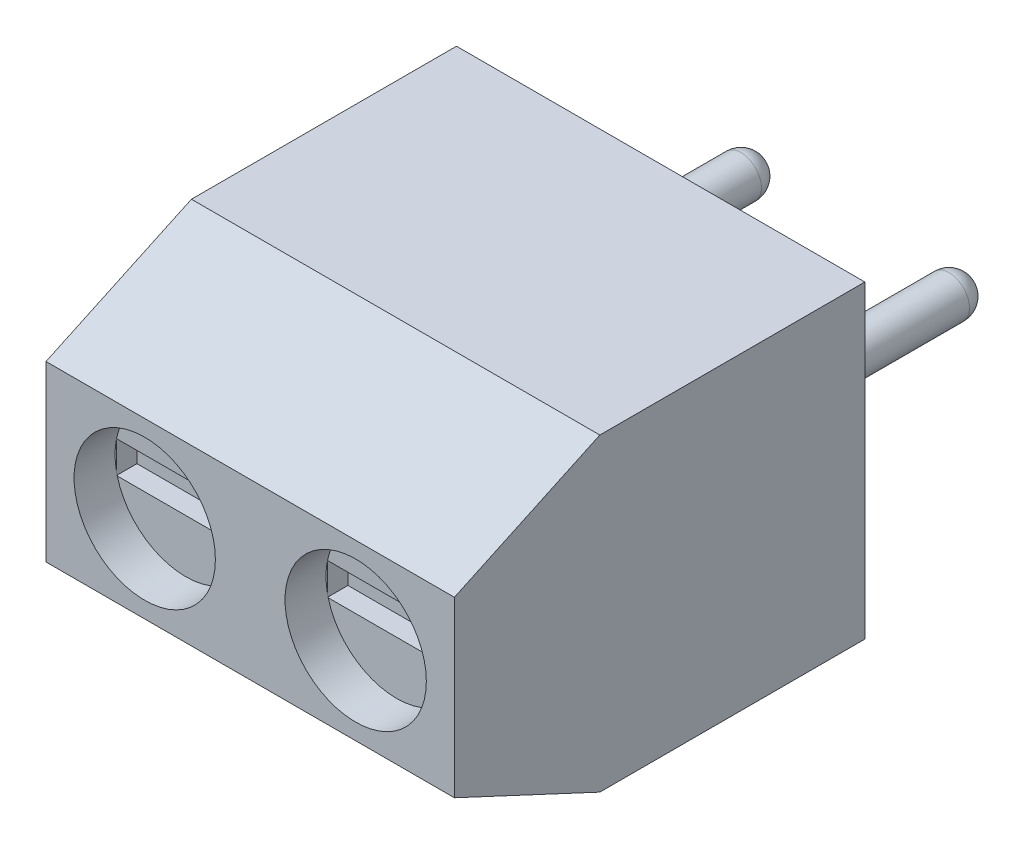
SolidWorks part; units mm, degrees
ref_plane "Face" through (0, 0, 0) normal (0, 0, 1) x (1, 0, 0)
ref_plane "Dessus" through (0, 0, 0) normal (0, 1, 0) x (1, 0, 0)
ref_plane "Droite" through (0, 0, 0) normal (1, 0, 0) x (0, 0, -1)
sketch "Esquisse1" plane through (0, 0, 0) normal (0, 0, 1) x (1, 0, 0)
  line L1 (0, 0) -> (9.97, 0)
  line L2 (0, 0) -> (0, 7.55)
  line L3 (0, 7.55) -> (9.97, 7.55)
  line L4 (9.97, 0) -> (9.97, 7.55)
  dimension "D1" = 9.97
  dimension "D2" = 7.55
extrude "Extrusion1" add sketch "Esquisse1" along normal blind 10.02
chamfer "Chanfrein1" distance 3.55 angle 25 2 edges at (4.985, 7.55, 10.02) (4.985, 0, 10.02)
sketch "Esquisse2" plane through (0, 0, 10.02) normal (0, 0, 1) x (1, 0, 0)
  line L0 (0, 3.775) -> (9.97, 3.775) construction
  line L1 (0, 5.8946) -> (0, 1.6554) construction
  line L2 (9.97, 1.6554) -> (9.97, 5.8946) construction
  line L3 (4.985, 5.8946) -> (4.985, 1.6554) construction
  line L4 (9.97, 5.8946) -> (0, 5.8946) construction
  line L5 (0, 1.6554) -> (9.97, 1.6554) construction
  circle A0 centre (2.4101, 3.775) radius 1.725
  circle A1 centre (7.5599, 3.775) radius 1.725
  dimension "D1" = 3.45
extrude "Enlèv. mat.-Extru.1" cut sketch "Esquisse2" against normal blind 1
sketch "Esquisse3" plane through (0, 0, 0) normal (0, -1, 0) x (1, 0, 0)
  line L0 (4.985, 6.47) -> (4.985, 0) construction
  line L1 (9.97, 6.47) -> (0, 6.47) construction
  line L2 (0, 0) -> (9.97, 0) construction
  line L4 (9.435, 5.8) -> (5.435, 5.8)
  line L5 (9.435, 5.8) -> (9.435, 0.8)
  line L6 (9.435, 0.8) -> (5.435, 0.8)
  line L7 (5.435, 5.8) -> (5.435, 0.8)
  line L8 (4.535, 5.8) -> (0.535, 5.8)
  line L9 (4.535, 5.8) -> (4.535, 0.8)
  line L10 (4.535, 0.8) -> (0.535, 0.8)
  line L11 (0.535, 5.8) -> (0.535, 0.8)
  dimension "D1" = 5
  dimension "D2" = 4
  dimension "D3" = 0.8
  dimension "D4" = 0.9
extrude "Enlèv. mat.-Extru.2" cut sketch "Esquisse3" against normal blind 1.6
sketch "Esquisse4" plane through (0, 1.6, 0) normal (0, -1, 0) x (1, 0, 0)
  line L0 (9.97, 3.235) -> (0, 3.235) construction
  line L1 (9.97, 6.47) -> (9.97, 0) construction
  line L2 (0, 6.47) -> (0, 0) construction
  line L3 (7.435, 5.8) -> (7.435, 0.8) construction
  line L4 (9.435, 5.8) -> (5.435, 5.8) construction
  line L5 (5.435, 0.8) -> (9.435, 0.8) construction
  line L6 (2.535, 5.8) -> (2.535, 0.8) construction
  line L7 (4.535, 5.8) -> (0.535, 5.8) construction
  line L8 (0.535, 0.8) -> (4.535, 0.8) construction
  circle A0 centre (7.435, 3.235) radius 1.675
  circle A1 centre (2.535, 3.235) radius 1.675
  dimension "D1" = 3.35
extrude "Enlèv. mat.-Extru.3" cut sketch "Esquisse4" against normal blind 1.6
sketch "Esquisse5" plane through (0, 0, 0) normal (0, 0, -1) x (-1, 0, 0)
  line L0 (-9.97, 3.775) -> (0, 3.775) construction
  line L1 (-9.97, 0) -> (-9.97, 7.55) construction
  line L2 (0, 7.55) -> (0, 0) construction
  line L3 (-4.985, 7.55) -> (-4.985, 0) construction
  line L4 (-9.97, 7.55) -> (0, 7.55) construction
  line L5 (0, 0) -> (-9.97, 0) construction
  circle A0 centre (-7.525, 3.775) radius 0.5
  circle A1 centre (-2.445, 3.775) radius 0.5
  dimension "D1" = 1
  dimension "D2" = 5.08
extrude "Extrusion2" add sketch "Esquisse5" along normal blind 5
fillet "Congé1" radius 0.5 2 edges at (1.945, 3.775, -5) (7.025, 3.775, -5)
sketch "Esquisse7" plane through (0, 0, 9.02) normal (0, 0, 1) x (1, 0, 0)
  line L1 (0.721, 4.1248) -> (4.0806, 4.1248)
  line L2 (0.721, 4.1248) -> (0.721, 3.3447)
  line L3 (0.721, 3.3447) -> (4.0806, 3.3447)
  line L4 (4.0806, 4.1248) -> (4.0806, 3.3447)
  line L5 (5.8707, 4.1248) -> (9.2304, 4.1248)
  line L6 (5.8707, 4.1248) -> (5.8707, 3.3447)
  line L7 (5.8707, 3.3447) -> (9.2304, 3.3447)
  line L8 (9.2304, 4.1248) -> (9.2304, 3.3447)
  circle A0 centre (2.4101, 3.775) radius 1.725 construction
  circle A1 centre (7.5599, 3.775) radius 1.725 construction
extrude "Enlèv. mat.-Extru.4" cut sketch "Esquisse7" against normal blind 0.5
sketch "Esquisse8" plane through (0, 3.2, 0) normal (0, -1, 0) x (1, 0, 0)
  line L1 (0.9436, 3.7576) -> (4.1396, 3.7576)
  line L2 (0.9436, 3.7576) -> (0.9436, 2.7545)
  line L3 (0.9436, 2.7545) -> (4.1396, 2.7545)
  line L4 (4.1396, 3.7576) -> (4.1396, 2.7545)
  line L5 (5.8436, 3.7576) -> (9.0396, 3.7576)
  line L6 (5.8436, 3.7576) -> (5.8436, 2.7545)
  line L7 (5.8436, 2.7545) -> (9.0396, 2.7545)
  line L8 (9.0396, 3.7576) -> (9.0396, 2.7545)
  circle A0 centre (2.535, 3.235) radius 1.675 construction
  circle A1 centre (7.435, 3.235) radius 1.675 construction
extrude "Enlèv. mat.-Extru.5" cut sketch "Esquisse8" against normal blind 0.5
